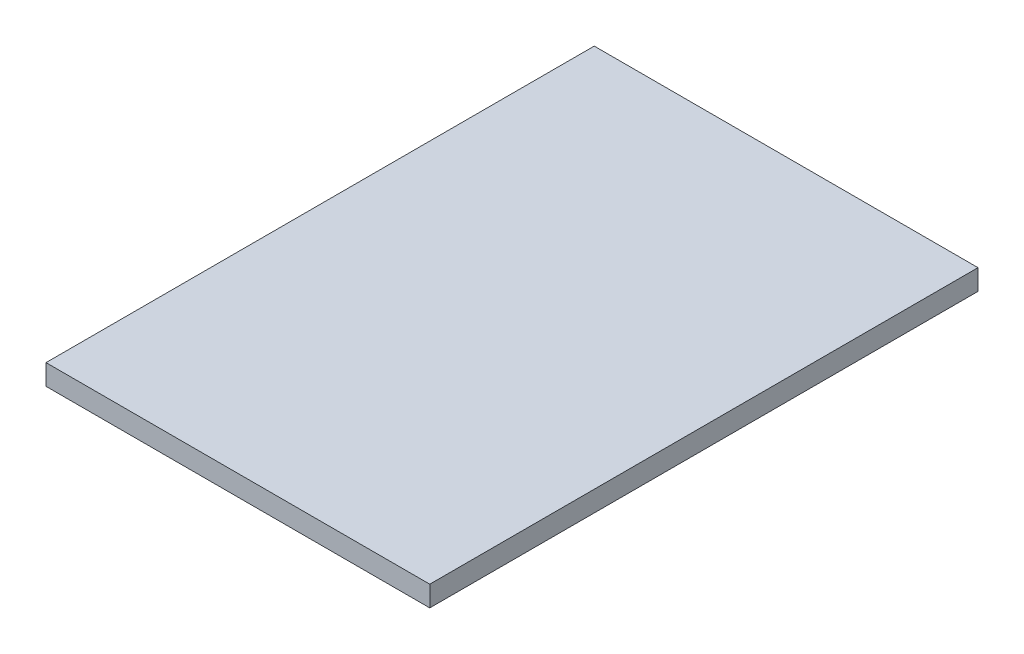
SolidWorks part; units mm, degrees
ref_plane "Front Plane" through (0, 0, 0) normal (0, 0, 1) x (1, 0, 0)
ref_plane "Top Plane" through (0, 0, 0) normal (0, 1, 0) x (1, 0, 0)
ref_plane "Right Plane" through (0, 0, 0) normal (1, 0, 0) x (0, 0, -1)
sketch "Sketch1" plane through (0, 0, 0) normal (0, 1, 0) x (1, 0, 0)
  line L1 (-177.8, 0) -> (177.8, 0)
  line L2 (-177.8, 0) -> (-177.8, 508)
  line L3 (-177.8, 508) -> (177.8, 508)
  line L4 (177.8, 0) -> (177.8, 508)
  dimension "D1" = 355.6
  dimension "D2" = 508
extrude "Boss-Extrude1" add sketch "Sketch1" along normal blind 19.05
sketch "Path" plane through (0, 19.05, 0) normal (0, 1, 0) x (1, 0, 0)
  line L5 (177.8, 508) -> (-177.8, 508) construction
  line L9 (-133.35, 463.55) -> (-133.35, 44.45)
  line L10 (-133.35, 44.45) -> (133.35, 44.45)
  line L11 (133.35, 44.45) -> (133.35, 463.55)
  line L14 (133.35, 463.55) -> (-133.35, 463.55)
  line L16 (-133.35, 431.8) -> (-133.35, 44.45)
  line L17 (-133.35, 44.45) -> (133.35, 44.45)
  line L18 (133.35, 44.45) -> (133.35, 431.8)
  arc A1 (-133.35, 431.8) -> (133.35, 431.8) centre (0, 167.64) cw
  dimension "D2" = 76.2
  dimension "D3" = 44.45
  dimension "D1" = 44.45
ref_plane "Profile Plane" through (-133.35, 19.05, -44.45) normal (0, 0, 1) x (1, 0, 0)
sketch "Profile" plane through (125.7969, 12.1622, -44.45) normal (0, 0, 1) x (-1, 0, 0)
  line L0 (-7.5531, -6.8878) -> (-7.5531, -3.7128)
  line L3 (0.3844, 4.2247) -> (5.1469, 4.2247)
  line L4 (5.1469, 4.2247) -> (36.337, -3.7128)
  line L5 (36.337, -3.7128) -> (36.8969, -6.8878)
  line L6 (36.8969, -6.8878) -> (-7.5531, -6.8878)
  line L7 (36.8969, -6.8878) -> (36.8969, -14.8253) construction
  arc A0 (-7.5531, -3.7128) -> (0.3844, 4.2247) centre (-7.5531, 4.2247) ccw
  dimension "D2" = 7.9375
  dimension "D1" = 3.175
  dimension "D3" = 3.175
  dimension "D4" = 4.7625
  dimension "D5" = 44.45
  dimension "D6" = 10
